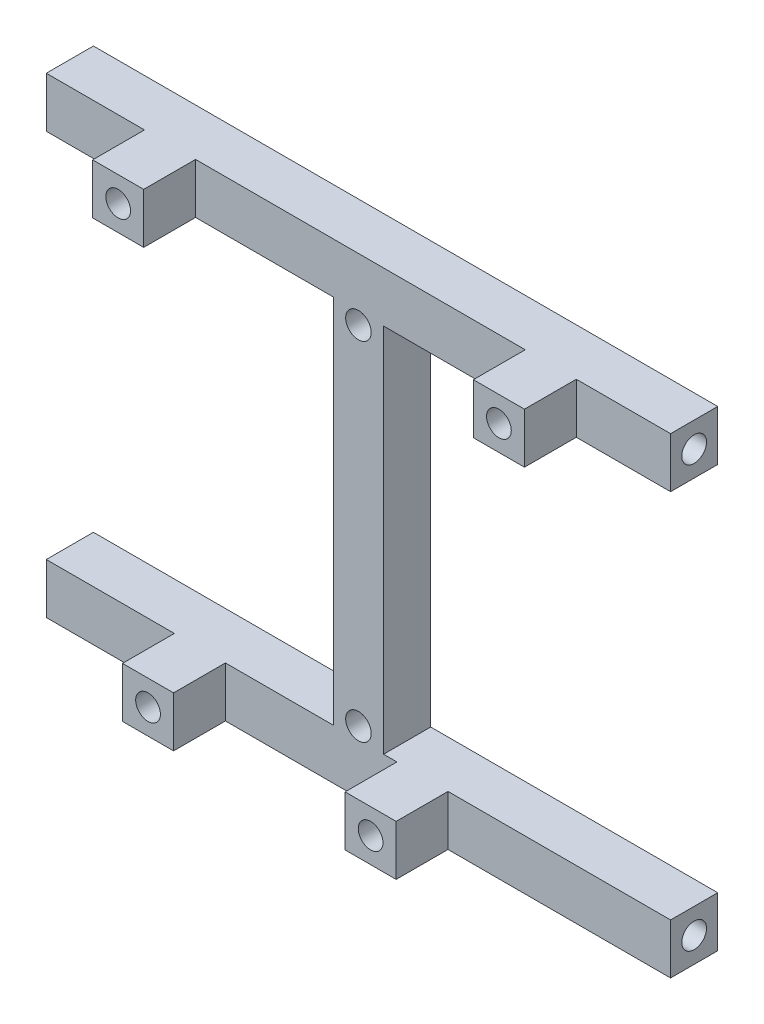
SolidWorks part; units mm, degrees
ref_plane "Front Plane" through (0, 0, 0) normal (0, 0, 1) x (1, 0, 0)
ref_plane "Top Plane" through (0, 0, 0) normal (0, 1, 0) x (1, 0, 0)
ref_plane "Right Plane" through (0, 0, 0) normal (1, 0, 0) x (0, 0, -1)
sketch "Sketch1" plane through (0, 0, 0) normal (0, 0, 1) x (1, 0, 0)
  line L1 (-39.73, -30) -> (39.73, -30)
  line L3 (-39.73, 30) -> (39.73, 30)
  line L5 (-39.73, -30) -> (39.73, 30) construction
  line L6 (-39.73, 30) -> (39.73, -30) construction
  line L8 (-39.73, 23.6) -> (-39.73, 30)
  line L9 (3.2, -23.6) -> (3.2, 23.6)
  line L10 (-3.2, -23.6) -> (-3.2, 23.6)
  line L11 (39.73, 23.6) -> (39.73, 30)
  line L12 (39.73, -23.6) -> (39.73, -30)
  line L13 (-39.73, -30) -> (-39.73, -23.6)
  line L14 (-39.73, -23.6) -> (-3.2, -23.6)
  line L15 (3.2, -23.6) -> (39.73, -23.6)
  line L16 (-39.73, 23.6) -> (-3.2, 23.6)
  line L17 (3.2, 23.6) -> (39.73, 23.6)
  point P0 (0, 0)
  dimension "D1" = 60
  dimension "D2" = 79.46
extrude "Boss-Extrude2" add sketch "Sketch1" along normal blind 6
sketch "Sketch2" plane through (0, 0, 6) normal (0, 0, 1) x (1, 0, 0)
  line L12 (21.23, 23.6) -> (27.73, 23.6)
  line L13 (27.73, 30) -> (21.23, 30)
  line L14 (27.73, 30) -> (27.73, 23.6)
  line L15 (-27.23, 30) -> (-20.73, 30)
  line L16 (21.23, 30) -> (21.23, 23.6)
  line L17 (-27.23, 23.6) -> (-27.23, 30)
  line L18 (-20.73, 23.6) -> (-20.73, 30)
  line L19 (-20.73, 23.6) -> (-27.23, 23.6)
  line L20 (-23.43, -30) -> (-16.93, -30)
  line L21 (-23.43, -30) -> (-23.43, -23.6)
  line L22 (-16.93, -30) -> (-16.93, -23.6)
  line L23 (-16.93, -23.6) -> (-23.43, -23.6)
  line L24 (4.9, -23.6) -> (11.4, -23.6)
  line L25 (11.4, -30) -> (11.4, -23.6)
  line L26 (4.9, -30) -> (4.9, -23.6)
  line L27 (11.4, -30) -> (4.9, -30)
extrude "Boss-Extrude3" add sketch "Sketch2" along normal blind 6.6
sketch "Sketch3" plane through (0, 0, 12.6) normal (0, 0, 1) x (1, 0, 0)
  line L0 (-23.43, -23.6) -> (-16.93, -30)
  line L1 (-16.93, -30) -> (-16.93, -23.6)
  line L2 (-16.93, -23.6) -> (-23.43, -30)
  line L3 (4.9, -23.6) -> (11.4, -30)
  line L4 (11.4, -30) -> (11.4, -23.6)
  line L5 (11.4, -23.6) -> (4.9, -30)
  line L6 (-27.23, 30) -> (-20.73, 23.6)
  line L7 (-20.73, 23.6) -> (-27.23, 23.6)
  line L8 (-27.23, 23.6) -> (-20.73, 30)
  line L9 (21.23, 23.6) -> (27.73, 30)
  line L10 (27.73, 30) -> (27.73, 23.6)
  line L11 (27.73, 23.6) -> (21.23, 30)
  circle A0 centre (-23.98, 26.8) radius 1.575
  circle A1 centre (24.48, 26.8) radius 1.575
  circle A2 centre (8.15, -26.8) radius 1.575
  circle A3 centre (-20.18, -26.8) radius 1.575
  dimension "D1" = 3.15
  dimension "D2" = 3.15
  dimension "D3" = 3.15
  dimension "D4" = 3.15
extrude "Cut-Extrude1" cut sketch "Sketch3" against normal blind 6.6 contours L2 A3 L0 | L2 A3 L0 | L0 A3 L2 | L0 A3 L2 | L5 A2 L3 | L3 A2 L5 | L5 A2 L3 | L3 A2 L5 | L8 A0 L6 | L6 A0 L8 | L8 A0 L6 | L6 A0 L8 | L9 A1 L11 | L11 A1 L9 | L9 A1 L11 | L11 A1 L9
sketch "Sketch4" plane through (0, 0, 6) normal (0, 0, 1) x (1, 0, 0)
  line L3 (-3.2, 0) -> (3.2, 0)
  line L4 (-3.2, 23.6) -> (-3.2, -23.6) construction
  line L5 (3.2, -23.6) -> (3.2, 23.6) construction
  line L6 (-3.2, -22.1) -> (3.2, -22.1)
  line L7 (-3.2, 22.1) -> (3.2, 22.1)
  circle A0 centre (0, 22.1) radius 1.625
  circle A1 centre (0, -22.1) radius 1.625
  dimension "D3" = 3.25
  dimension "D4" = 3.25
  dimension "D1" = 22.1
  dimension "D2" = 22.1
extrude "Cut-Extrude2" cut sketch "Sketch4" against normal through all contours L7 A0 | L7 A0 | L6 A1 | L6 A1
sketch "Sketch5" plane through (39.73, 0, 0) normal (1, 0, 0) x (0, 0, -1)
  line L0 (-6, 23.6) -> (0, 30)
  line L1 (-6, -30) -> (0, -23.6)
  circle A0 centre (-3, -26.8) radius 1.575
  circle A1 centre (-3, 26.8) radius 1.575
  dimension "D1" = 3.15
  dimension "D2" = 3.15
extrude "Cut-Extrude3" cut sketch "Sketch5" against normal blind 11 contours L1 A0 | L1 A0 | L0 A1 | L0 A1
sketch "Sketch6" plane through (-39.73, 0, 0) normal (-1, 0, 0) x (0, 0, 1)
  line L0 (0, 30) -> (6, 23.6)
  line L1 (0, -23.6) -> (6, -30)
  circle A0 centre (3, -26.8) radius 1.575
  circle A1 centre (3, 26.8) radius 1.575
  dimension "D1" = 3.15
  dimension "D2" = 3.15
extrude "Cut-Extrude4" cut sketch "Sketch6" against normal blind 11 contours L0 A1 | L0 A1 | L1 A0 | L1 A0
